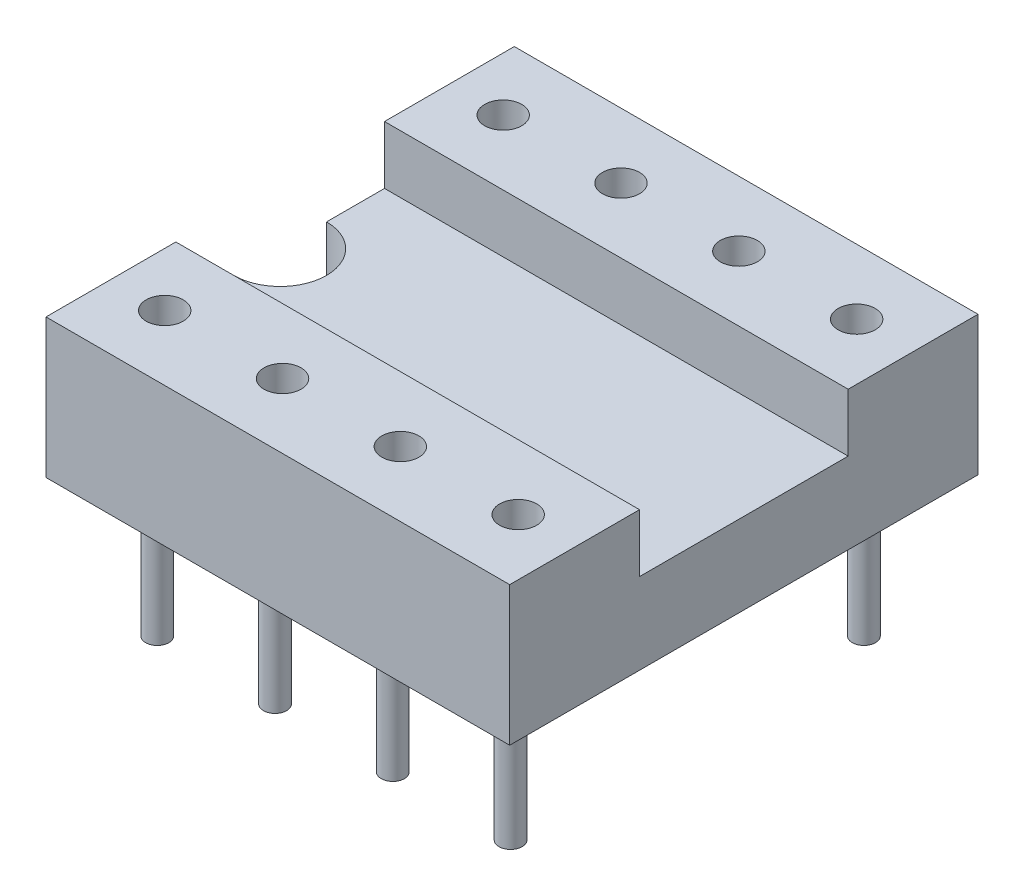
SolidWorks part; units mm, degrees
ref_plane "Plan de face" through (0, 0, 0) normal (0, 0, 1) x (1, 0, 0)
ref_plane "Plan de dessus" through (0, 0, 0) normal (0, 1, 0) x (1, 0, 0)
ref_plane "Plan de droite" through (0, 0, 0) normal (1, 0, 0) x (0, 0, -1)
sketch "Esquisse1" plane through (0, 0, 0) normal (1, 0, 0) x (0, 0, -1)
  line L0 (12.2051, 0) -> (-23.3437, 0) construction
  line L1 (0, -4.6214) -> (0, 25.9507) construction
  line L2 (-5.7968, 1.75) -> (2.763, 1.75) construction
  line L3 (5.7565, 3) -> (-6.8307, 3) construction
  line L4 (5.05, 3.8077) -> (5.05, -1.0493) construction
  line L5 (-5.05, 3.7235) -> (-5.05, -1.0493) construction
  line L6 (-2.25, 3.5071) -> (-2.25, 0.8142) construction
  line L7 (2.25, 3.5071) -> (2.25, 0.8142) construction
  line L8 (-2.25, 1.75) -> (-2.25, 3)
  line L9 (-2.25, 3) -> (-5.05, 3)
  line L10 (-5.05, 3) -> (-5.05, 0)
  line L11 (-5.05, 0) -> (5.05, 0)
  line L12 (5.05, 0) -> (5.05, 3)
  line L13 (5.05, 3) -> (2.25, 3)
  line L14 (2.25, 3) -> (2.25, 1.75)
  line L15 (2.25, 1.75) -> (-2.25, 1.75)
  dimension "D1" = 1.75
  dimension "D2" = 3
  dimension "D3" = 5.05
  dimension "D4" = 5.05
  dimension "D5" = 2.8
  dimension "D6" = 2.8
extrude "Extrusion1" add sketch "Esquisse1" along normal blind 10
sketch "Esquisse2" plane through (0, 1.75, 0) normal (0, 1, 0) x (-1, 0, 0)
  line L0 (0, -1) -> (0, 1)
  arc A0 (0, 1) -> (0, -1) centre (0, 0) ccw
extrude "Enlèv. mat.-Extru.1" cut sketch "Esquisse2" against normal through all
sketch "Esquisse3" plane through (0, 3, 0) normal (0, 1, 0) x (-1, 0, 0)
  line L0 (-13.1576, 5.05) -> (2.3638, 5.05) construction
  line L1 (0, 6.1465) -> (0, -6.3771) construction
  line L2 (1.5124, 0) -> (-12.9979, 0) construction
  line L3 (1.0512, 3.65) -> (-15.6055, 3.65) construction
  line L4 (-1.16, 6.2884) -> (-1.16, 1.7827) construction
  circle A0 centre (-1.16, 3.65) radius 0.4
  circle A1 centre (-1.16, -3.65) radius 0.4
  circle A2 centre (-3.701, 3.65) radius 0.4
  circle A3 centre (-3.701, -3.65) radius 0.4
  circle A4 centre (-6.242, 3.65) radius 0.4
  circle A5 centre (-6.242, -3.65) radius 0.4
  circle A6 centre (-8.783, 3.65) radius 0.4
  circle A7 centre (-8.783, -3.65) radius 0.4
  dimension "D1" = 1.4
  dimension "D2" = 1.16
extrude "Enlèv. mat.-Extru.2" cut sketch "Esquisse3" against normal blind 2.5
sketch "Esquisse5" plane through (0, 0, 0) normal (0, -1, 0) x (1, 0, 0)
  line L0 (-0.4263, 0) -> (10.6481, 0) construction
  line L1 (10.6481, 3.81) -> (-0.4263, 3.81) construction
  circle A0 centre (1.16, 3.81) radius 0.25
  circle A1 centre (1.16, -3.81) radius 0.25
  circle A2 centre (3.7, -3.81) radius 0.25
  circle A3 centre (3.7, 3.81) radius 0.25
  circle A4 centre (6.24, -3.81) radius 0.25
  circle A5 centre (6.24, 3.81) radius 0.25
  circle A6 centre (8.78, -3.81) radius 0.25
  circle A7 centre (8.78, 3.81) radius 0.25
  dimension "D1" = 4
  dimension "D2" = 3.81
extrude "Extrusion2" add sketch "Esquisse5" along normal blind 3
